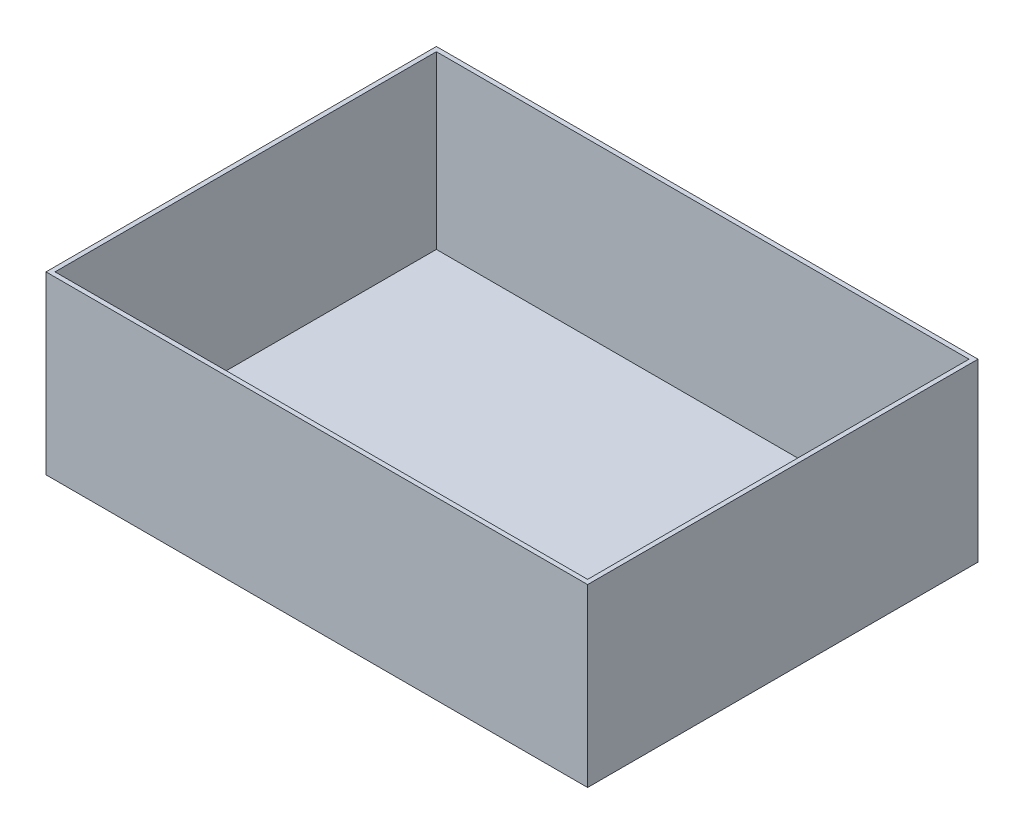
SolidWorks part; units mm, degrees
ref_plane "Front Plane" through (0, 0, 0) normal (0, 0, 1) x (1, 0, 0)
ref_plane "Top Plane" through (0, 0, 0) normal (0, 1, 0) x (1, 0, 0)
ref_plane "Right Plane" through (0, 0, 0) normal (1, 0, 0) x (0, 0, -1)
sketch "Sketch1" plane through (0, 0, 0) normal (0, 1, 0) x (1, 0, 0)
  line L0 (76.3087, 55.0025) -> (-76.3087, -55.0025) construction
  line L1 (-76.3087, 55.0025) -> (76.3087, 55.0025)
  line L2 (-76.3087, 55.0025) -> (-76.3087, -55.0025)
  line L3 (-76.3087, -55.0025) -> (76.3087, -55.0025)
  line L4 (76.3087, 55.0025) -> (76.3087, -55.0025)
extrude "Extrude1" add sketch "Sketch1" along normal blind 49.53
shell "Shell1" thickness 1.27
